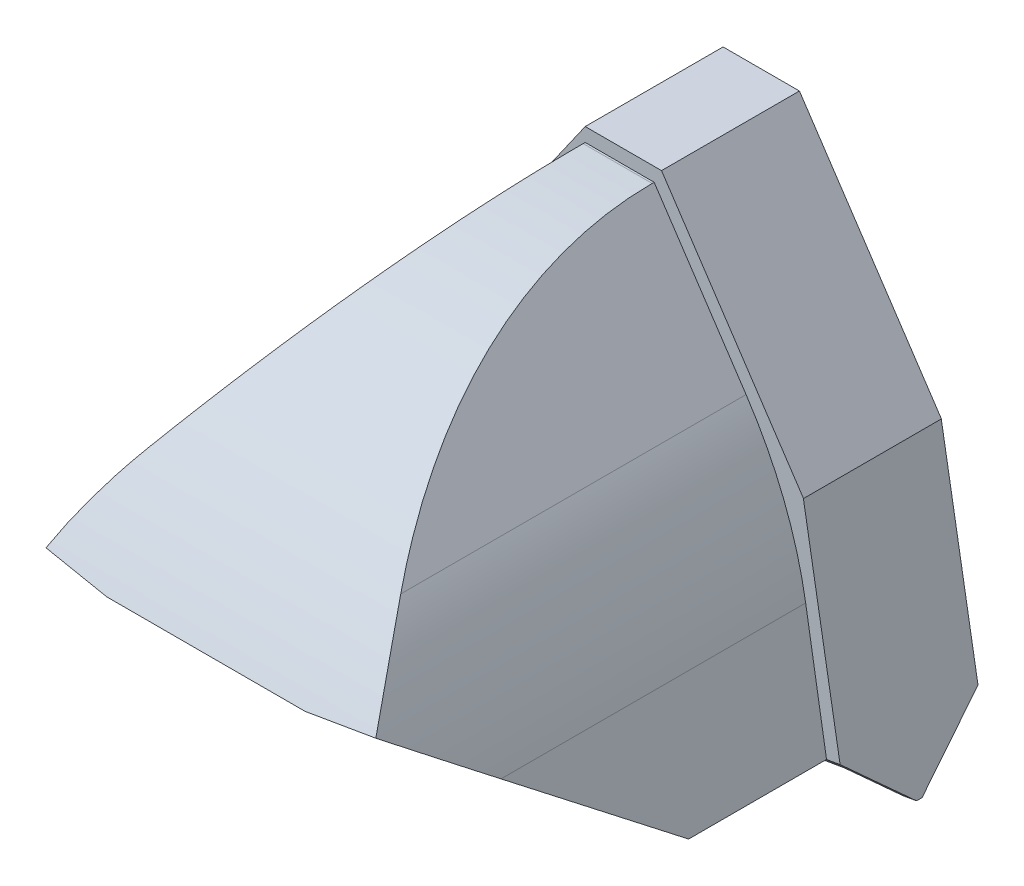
SolidWorks part; units mm, degrees
ref_plane "Front Plane" through (0, 0, 0) normal (0, 0, 1) x (1, 0, 0)
ref_plane "Top Plane" through (0, 0, 0) normal (0, 1, 0) x (1, 0, 0)
ref_plane "Right Plane" through (0, 0, 0) normal (1, 0, 0) x (0, 0, -1)
sketch "Sketch2" plane through (0, 0, 0) normal (0, 0, 1) x (1, 0, 0)
  line L0 (0, 0) -> (6.35, 38.1)
  line L1 (6.35, 38.1) -> (31.75, 76.2)
  line L2 (31.75, 76.2) -> (44.45, 76.2)
  line L3 (69.85, 38.1) -> (76.2, 0)
  line L4 (44.45, 76.2) -> (69.85, 38.1)
  dimension "D1" = 38.1
  dimension "D2" = 38.1
  dimension "D3" = 38.1
  dimension "D4" = 38.1
  dimension "D5" = 63.5
  dimension "D6" = 76.2
  dimension "D7" = 25.4
  dimension "D8" = 31.75
  dimension "D9" = 12.7
extrude "Extrude-Thin1" add sketch "Sketch2" along normal blind 101.6 thin
sketch "Sketch3" plane through (74.1405, 12.3568, 0) normal (0.9864, 0.1644, 0) x (0, 0, -1)
  line L6 (-101.6, 26.0983) -> (-101.6, -12.5272)
  line L7 (-101.6, -12.5272) -> (-50.8, -12.5272)
  line L8 (-101.6, -12.5272) -> (0, -12.5272) construction
  line L9 (-50.8, -12.5272) -> (-101.6, 26.0983)
  dimension "D1" = 50.8
extrude "Cut-Extrude1" cut sketch "Sketch3" against normal blind 47.752
sketch "Sketch12" plane through (0, 0, 0) normal (-0.9864, 0.1644, 0) x (0, 0, 1)
  line L0 (101.6, 0) -> (101.6, 38.6255)
  line L1 (101.6, 38.6255) -> (50.8, 0)
  line L2 (101.6, 0) -> (0, 0) construction
  line L3 (50.8, 0) -> (101.6, 0)
  dimension "D1" = 50.8
extrude "Cut-Extrude5" cut sketch "Sketch12" against normal blind 27.94
sketch "Sketch4" plane through (0, 0, 0) normal (0, 0, -1) x (-1, 0, 0)
  line L4 (-80.595, -10.497) -> (-71.9295, 39.5585)
  line L5 (-71.9295, 39.5585) -> (-44.45, 78.74)
  line L6 (-44.45, 78.74) -> (-31.75, 78.74)
  line L7 (-4.2366, 39.5089) -> (4.3974, -10.552)
  line L11 (-6.35, 38.1) -> (-31.75, 76.2) construction
  line L13 (-31.75, 78.74) -> (-4.2366, 39.5089)
  line L14 (-64.9255, -1.8791) -> (-58.9788, 33.801)
  line L15 (-58.9788, 33.801) -> (-38.3328, 64.77)
  line L16 (-37.8672, 64.77) -> (-17.2212, 33.801)
  line L17 (-17.2212, 33.801) -> (-11.2745, -1.8791)
  line L18 (-11.2745, -1.8791) -> (0, 0)
  line L19 (0, 0) -> (-6.35, 38.1)
  line L20 (-6.35, 38.1) -> (-31.75, 76.2)
  line L21 (-58.9788, 33.801) -> (-38.3328, 64.77)
  line L22 (-69.85, 38.1) -> (-76.2, 0)
  line L23 (-76.2, 0) -> (-64.9255, -1.8791)
  line L24 (-64.9255, -1.8791) -> (-58.9788, 33.801)
  line L26 (-37.8672, 64.77) -> (-17.2212, 33.801)
  line L27 (-17.2212, 33.801) -> (-11.2745, -1.8791)
  line L28 (-11.2745, -1.8791) -> (0, 0)
  line L33 (-76.2, 0) -> (-64.9255, -1.8791)
  line L45 (-38.3328, 64.77) -> (-37.8672, 64.77)
  line L46 (-38.3328, 64.77) -> (-37.8672, 64.77)
  line L47 (-31.75, 76.2) -> (-44.45, 76.2)
  line L48 (-31.75, 76.2) -> (-44.45, 76.2)
  line L49 (-44.45, 76.2) -> (-69.85, 38.1)
  line L50 (-44.45, 76.2) -> (-69.85, 38.1)
  dimension "D2" = 2.54
  dimension "D3" = 2.54
  dimension "D4" = 2.54
  dimension "D5" = 2.54
  dimension "D6" = 50.8
  dimension "D7" = 50.8
  dimension "D8" = 2.54
  dimension "D9" = 2.54
  dimension "D10" = 2.54
  dimension "D11" = 2.54
  dimension "D12" = 2.54
  dimension "D1" = 0
extrude "Extrude-Thin2" add sketch "Sketch4" against normal blind 25.4 thin
sketch "Sketch5" plane through (76.4855, 13.2409, 0) normal (0.9853, 0.1706, 0) x (0, 0, -1)
  line L9 (-25.4, -24.091) -> (0, -24.091) construction
  line L11 (-25.4, -24.091) -> (-25.4, -12.9982)
  line L13 (0, -24.091) -> (0, 26.6434) construction
  line L14 (0, -12.9982) -> (0, -24.091)
  line L16 (-12.192, -24.091) -> (0, -24.091)
  line L17 (-12.192, -24.091) -> (0, -12.9982)
  line L18 (-25.4, -12.9982) -> (-13.208, -24.091)
  line L19 (-13.208, -24.091) -> (-25.4, -24.091)
  dimension "D1" = 12.192
  dimension "D2" = 12.192
extrude "Cut-Extrude2" cut sketch "Sketch5" against normal blind 23.368
sketch "Sketch6" plane through (-2.503, 0.4317, 0) normal (-0.9855, 0.17, 0) x (0, 0, 1)
  line L12 (0, 0) -> (12.7, -11.1458)
  line L13 (25.4, -11.1458) -> (0, -11.1458) construction
  line L14 (12.7, -11.1458) -> (0, -11.1458)
  line L15 (0, -11.1458) -> (0, 0)
  line L16 (12.7, -11.1458) -> (25.4, -11.1458)
  line L17 (25.4, -11.1458) -> (25.4, 0)
  line L18 (25.4, 39.6542) -> (25.4, -11.1458) construction
  line L19 (50.8, 0) -> (25.4, 0) construction
  line L20 (25.4, 0) -> (12.7, -11.1458)
extrude "Cut-Extrude3" cut sketch "Sketch6" against normal blind 23.368
fillet "Fillet2" radius 71.12 4 edges at (6.35, 38.1, 63.5) (17.2212, 33.801, 61.8867) (58.9788, 33.801, 61.8867) (69.85, 38.1, 63.5)
sketch "Sketch17" plane through (0, 0, 101.6) normal (0, 0, 1) x (1, 0, 0)
  line L0 (19.8364, 35.8523) -> (56.3636, 35.8523)
  arc A0 (19.8364, 35.8523) -> (37.8672, 64.77) centre (76.7002, 20.4767) cw
  arc A1 (38.3328, 64.77) -> (37.8672, 64.77) centre (38.1, 49.0236) ccw
  arc A2 (56.3636, 35.8523) -> (38.3328, 64.77) centre (-26.6188, 4.1912) ccw
extrude "Boss-Extrude3" add sketch "Sketch17" against normal blind 2.54
fillet "Fillet5" radius 91.44 1 edges at (38.1, 76.2, 101.6)
fillet "Fillet8" radius 48.26 1 edges at (38.1, 64.77, 99.06)
